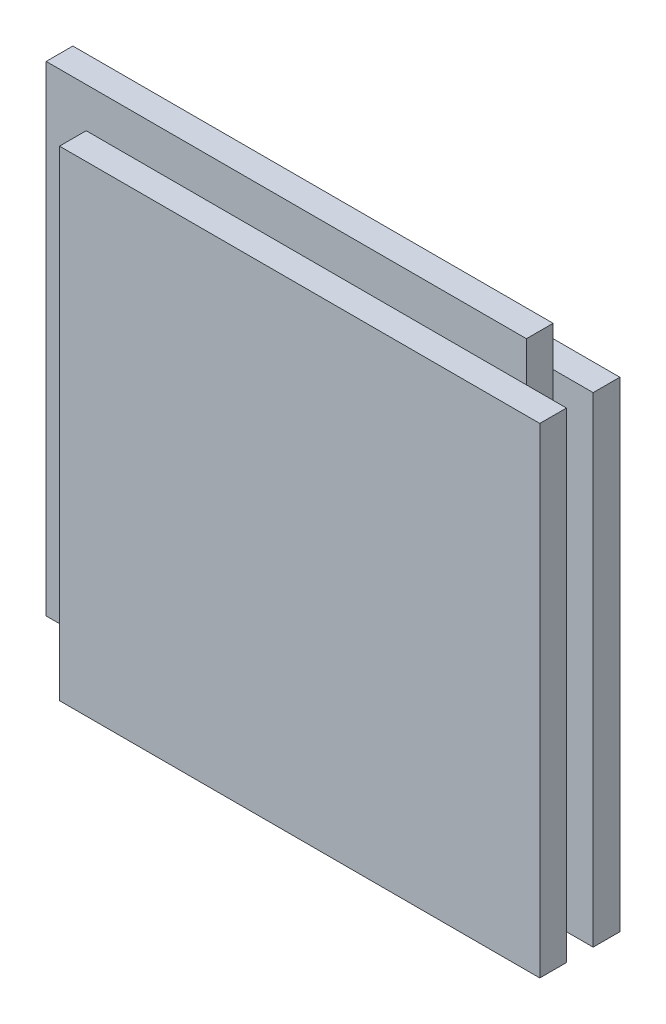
SolidWorks part; units mm, degrees
ref_plane "Front Plane" through (0, 0, 0) normal (0, 0, 1) x (1, 0, 0)
ref_plane "Top Plane" through (0, 0, 0) normal (0, 1, 0) x (1, 0, 0)
ref_plane "Right Plane" through (0, 0, 0) normal (1, 0, 0) x (0, 0, -1)
sketch "Sketch1" plane through (0, 0, 0) normal (0, 0, 1) x (1, 0, 0)
  line L1 (-90, 90) -> (90, 90)
  line L2 (-90, 90) -> (-90, -90)
  line L3 (-90, -90) -> (90, -90)
  line L4 (90, 90) -> (90, -90)
  line L5 (-90, 90) -> (90, -90) construction
  line L6 (-90, -90) -> (90, 90) construction
  point P0 (0, 0)
  dimension "D1" = 180
extrude "Boss-Extrude1" add sketch "Sketch1" along normal mid plane 10
sketch "Sketch2" plane through (0, 0, 5) normal (0, 0, 1) x (1, 0, 0)
  line L0 (90, 90) -> (-90, 90) construction
  line L1 (105, -105) -> (-75, -105)
  line L2 (105, -105) -> (105, 75)
  line L3 (105, 75) -> (-75, 75)
  line L4 (-75, -105) -> (-75, 75)
  line L5 (105, -105) -> (-75, 75) construction
  line L6 (105, 75) -> (-75, -105) construction
  line L7 (-90, 90) -> (-90, -90) construction
  point P0 (15, -15)
  dimension "D1" = 15
  dimension "D2" = 15
  dimension "D3" = 180
extrude "Boss-Extrude2" add sketch "Sketch2" along normal blind 10
sketch "Sketch3" plane through (0, 0, -5) normal (0, 0, -1) x (-1, 0, 0)
  line L0 (-105, -105) -> (-105, 75) construction
  line L1 (75, -105) -> (-105, -105) construction
  line L2 (75, 75) -> (75, -105) construction
  line L3 (-105, 75) -> (75, 75) construction
  line L4 (-105, -105) -> (-105, 75)
  line L5 (75, -105) -> (-105, -105)
  line L6 (75, 75) -> (75, -105)
  line L7 (-105, 75) -> (75, 75)
extrude "Boss-Extrude3" add sketch "Sketch3" along normal blind 10
